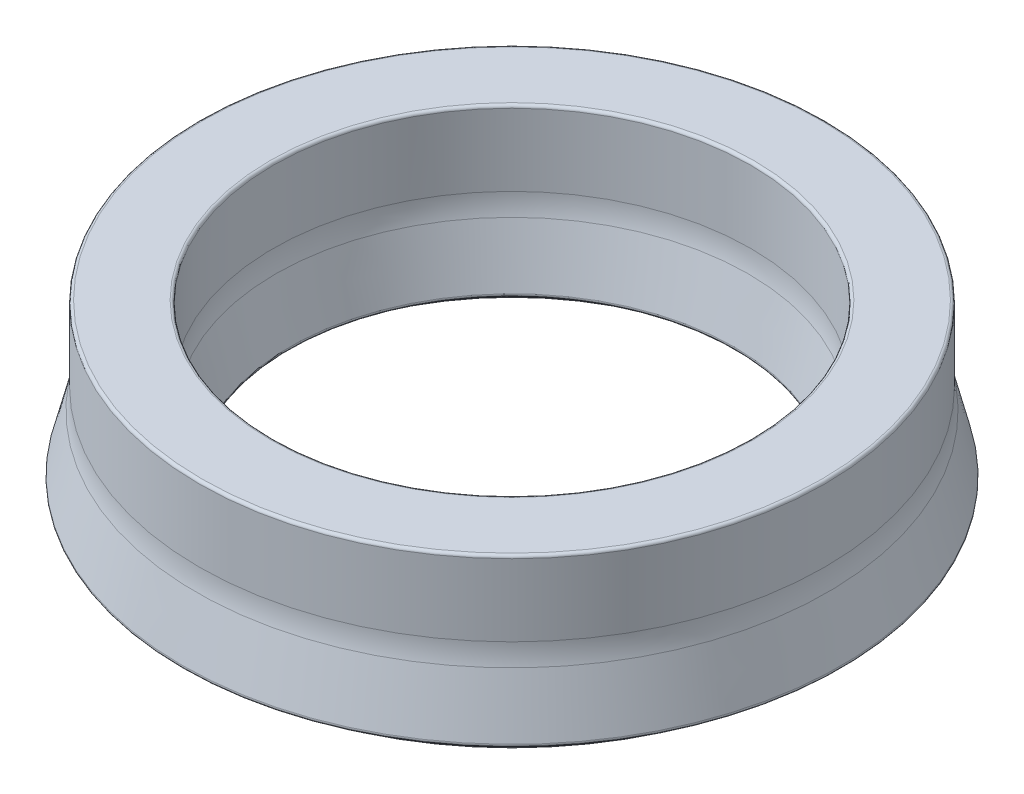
SolidWorks part; units mm, degrees
ref_plane "Front" through (0, 0, 0) normal (0, 0, 1) x (1, 0, 0)
ref_plane "Top" through (0, 0, 0) normal (0, 1, 0) x (1, 0, 0)
ref_plane "Right" through (0, 0, 0) normal (1, 0, 0) x (0, 0, -1)
sketch "Sketch1" plane through (0, 0, 0) normal (0, 0, 1) x (1, 0, 0)
  line L0 (0, 0) -> (0, 1.0386) construction
  line L8 (3.429, 0) -> (3.302, 0)
  line L15 (3.683, 0.1905) -> (3.4925, 0.9525)
  line L16 (2.4765, 0.1905) -> (2.667, 0.9525)
  line L17 (2.8575, 1.397) -> (3.302, 1.397)
  line L18 (2.7305, 0) -> (2.4765, 0.1905)
  line L19 (3.4925, 0.9525) -> (3.4925, 1.905)
  line L20 (2.8575, 0) -> (2.8575, 1.397)
  line L21 (3.302, 0) -> (3.302, 1.397)
  line L22 (2.7305, 0) -> (2.8575, 0)
  line L23 (3.429, 0) -> (3.683, 0.1905)
  line L24 (2.667, 1.905) -> (3.4925, 1.905)
  line L25 (2.667, 0.9525) -> (2.667, 1.905)
  dimension "D1" = 2.4765
  dimension "D2" = 0.254
  dimension "D3" = 1.905
  dimension "D4" = 0.762
  dimension "D5" = 0.1905
  dimension "D6" = 3.683
  dimension "D7" = 0.127
  dimension "D8" = 0.508
  dimension "D9" = 0.1905
revolve "Revolve1" add sketch "Sketch1" angle 360 about L0
fillet "Fillet1" radius 0.9525 2 edges at (0, 0.9525, -2.667) (0, 0.9525, -3.4925)
fillet "Fillet2" radius 0.0318 10 edges at (0, 0, -3.429) (0, 0, -3.302) (0, 1.397, -3.302) (0, 1.397, -2.8575) (0, 0, -2.8575) (0, 0, -2.7305) (0, 0.1905, -2.4765) (0, 1.905, -2.667) (0, 1.905, -3.4925) (0, 0.1905, -3.683)
